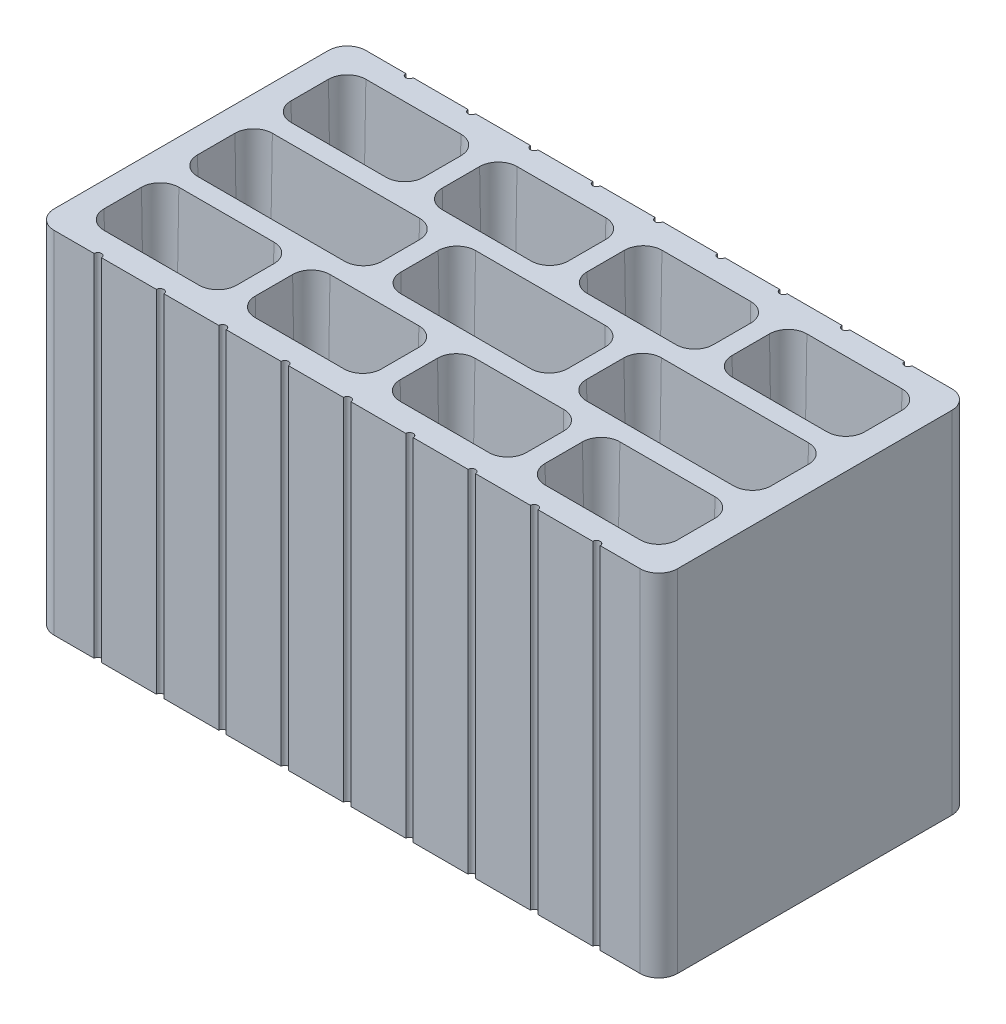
SolidWorks part; units mm, degrees
ref_plane "Plan de face" through (0, 0, 0) normal (0, 0, 1) x (1, 0, 0)
ref_plane "Plan de dessus" through (0, 0, 0) normal (0, 1, 0) x (1, 0, 0)
ref_plane "Plan de droite" through (0, 0, 0) normal (1, 0, 0) x (0, 0, -1)
sketch "Esquisse1" plane through (0, 0, 0) normal (0, 1, 0) x (1, 0, 0)
  line L0 (-4.5271, 0) -> (72.4679, 0) construction
  line L1 (1.5, 0) -> (4.7, 0)
  line L2 (0, 1.5) -> (0, 23.5)
  line L3 (1.5, 25) -> (4.7, 25)
  line L4 (50, 1.5) -> (50, 23.5)
  line L5 (0, -4.2553) -> (0, 43.6965) construction
  line L6 (25, -2.4119) -> (25, 43.6965) construction
  line L7 (-4.5271, 12.5) -> (72.4679, 12.5) construction
  line L8 (12.625, -2.4119) -> (12.625, 14.3543) construction
  line L9 (-4.5271, 2) -> (51.055, 2) construction
  line L10 (2, 28.4811) -> (2, -4.2553) construction
  line L11 (-3.7698, 9.5) -> (51.8514, 9.5) construction
  line L12 (-2.4036, 8.75) -> (-0.3375, 8.75) construction
  line L13 (8, 13.5253) -> (8, 5.2262) construction
  line L14 (3.5, 8) -> (11.125, 8)
  line L15 (2, 6.5) -> (2, 3.5)
  line L16 (13.375, -4.2553) -> (13.375, 14.3543) construction
  line L17 (14.125, -2.4119) -> (14.125, 14.3543) construction
  line L18 (-3.7698, 8) -> (25.3515, 8) construction
  line L19 (3.5, 2) -> (11.125, 2)
  line L20 (12.625, 6.5) -> (12.625, 3.5)
  line L21 (15.625, 8) -> (22.75, 8)
  line L22 (14.125, 6.5) -> (14.125, 3.5)
  line L23 (15.625, 2) -> (22.75, 2)
  line L24 (16.8, 4.1469) -> (16.8, 16.2448) construction
  line L25 (8.625, 13.5253) -> (8.625, 6.2202) construction
  line L26 (9.25, 13.5253) -> (9.25, 5.2262) construction
  line L27 (24.25, 6.5) -> (24.25, 3.5)
  line L28 (48, -3.2031) -> (48, 26.4901) construction
  line L29 (-3.1448, 23) -> (51.68, 23) construction
  line L30 (34.375, 17) -> (27.25, 17)
  line L31 (25.75, 1.0051) -> (25.75, -4.2553) construction
  line L32 (18.3, 4.1469) -> (18.3, 16.2448) construction
  line L33 (19.8, 15.5) -> (30.2, 15.5)
  line L34 (3.5, 15.5) -> (15.3, 15.5)
  line L35 (2, 14) -> (2, 11)
  line L36 (3.5, 9.5) -> (15.3, 9.5)
  line L37 (16.8, 14) -> (16.8, 11)
  line L38 (18.3, 14) -> (18.3, 11)
  line L39 (-3.2698, 15.5) -> (52.3514, 15.5) construction
  line L40 (30.2, 9.5) -> (19.8, 9.5)
  line L41 (31.7, 4.1469) -> (31.7, 16.2448) construction
  line L42 (40.75, 13.5253) -> (40.75, 5.2262) construction
  line L43 (41.375, 13.5253) -> (41.375, 6.2202) construction
  line L44 (33.2, 4.1469) -> (33.2, 16.2448) construction
  line L45 (42, 13.5253) -> (42, 5.2262) construction
  line L46 (46.5, 17) -> (38.875, 17)
  line L47 (48, 18.5) -> (48, 21.5)
  line L48 (46.5, 23) -> (38.875, 23)
  line L49 (37.375, 18.5) -> (37.375, 21.5)
  line L50 (35.875, 18.5) -> (35.875, 21.5)
  line L51 (34.375, 23) -> (27.25, 23)
  line L52 (25.75, 18.5) -> (25.75, 21.5)
  line L53 (24.25, 18.5) -> (24.25, 21.5)
  line L54 (12.625, 18.5) -> (12.625, 21.5)
  line L55 (3.5, 23) -> (11.125, 23)
  line L56 (2, 18.5) -> (2, 21.5)
  line L57 (3.5, 17) -> (11.125, 17)
  line L58 (15.625, 23) -> (22.75, 23)
  line L59 (14.125, 18.5) -> (14.125, 21.5)
  line L60 (31.7, 14) -> (31.7, 11)
  line L61 (33.2, 14) -> (33.2, 11)
  line L62 (46.5, 9.5) -> (34.7, 9.5)
  line L63 (48, 14) -> (48, 11)
  line L64 (46.5, 15.5) -> (34.7, 15.5)
  line L65 (15.625, 17) -> (22.75, 17)
  line L66 (25.75, 6.5) -> (25.75, 3.5)
  line L67 (34.375, 2) -> (27.25, 2)
  line L68 (35.875, 6.5) -> (35.875, 3.5)
  line L69 (34.375, 8) -> (27.25, 8)
  line L70 (37.375, 6.5) -> (37.375, 3.5)
  line L71 (46.5, 2) -> (38.875, 2)
  line L72 (48, 6.5) -> (48, 3.5)
  line L73 (46.5, 8) -> (38.875, 8)
  line L74 (5.3, 0) -> (9.7, 0)
  line L75 (10.3, 0) -> (14.7, 0)
  line L76 (15.3, 0) -> (19.7, 0)
  line L77 (20.3, 0) -> (24.7, 0)
  line L78 (25.3, 0) -> (29.7, 0)
  line L79 (30.3, 0) -> (34.7, 0)
  line L80 (35.3, 0) -> (39.7, 0)
  line L81 (40.3, 0) -> (44.7, 0)
  line L82 (45.3, 0) -> (48.5, 0)
  line L83 (5.3, 25) -> (9.7, 25)
  line L84 (10.3, 25) -> (14.7, 25)
  line L85 (15.3, 25) -> (19.7, 25)
  line L86 (20.3, 25) -> (24.7, 25)
  line L87 (45.3, 25) -> (48.5, 25)
  line L88 (40.3, 25) -> (44.7, 25)
  line L89 (35.3, 25) -> (39.7, 25)
  line L90 (30.3, 25) -> (34.7, 25)
  line L91 (25.3, 25) -> (29.7, 25)
  line L98 (24.25, -4.2553) -> (24.25, 28.4811) construction
  arc A0 (45.3, 25) -> (44.7, 25) centre (45, 25) cw
  arc A1 (5.3, 0) -> (4.7, 0) centre (5, 0) ccw
  arc A2 (10.3, 0) -> (9.7, 0) centre (10, 0) ccw
  arc A3 (15.3, 0) -> (14.7, 0) centre (15, 0) ccw
  arc A4 (20.3, 0) -> (19.7, 0) centre (20, 0) ccw
  arc A5 (25.3, 0) -> (24.7, 0) centre (25, 0) ccw
  arc A6 (30.3, 0) -> (29.7, 0) centre (30, 0) ccw
  arc A7 (35.3, 0) -> (34.7, 0) centre (35, 0) ccw
  arc A8 (40.3, 0) -> (39.7, 0) centre (40, 0) ccw
  arc A9 (45.3, 0) -> (44.7, 0) centre (45, 0) ccw
  circle A10 centre (0, 0) radius 0.3
  arc A11 (40.3, 25) -> (39.7, 25) centre (40, 25) cw
  arc A12 (35.3, 25) -> (34.7, 25) centre (35, 25) cw
  arc A13 (30.3, 25) -> (29.7, 25) centre (30, 25) cw
  arc A14 (25.3, 25) -> (24.7, 25) centre (25, 25) cw
  arc A15 (20.3, 25) -> (19.7, 25) centre (20, 25) cw
  arc A16 (15.3, 25) -> (14.7, 25) centre (15, 25) cw
  arc A17 (10.3, 25) -> (9.7, 25) centre (10, 25) cw
  arc A18 (5.3, 25) -> (4.7, 25) centre (5, 25) cw
  arc A19 (48, 21.5) -> (46.5, 23) centre (46.5, 21.5) ccw
  arc A20 (46.5, 17) -> (48, 18.5) centre (46.5, 18.5) ccw
  arc A21 (48, 14) -> (46.5, 15.5) centre (46.5, 14) ccw
  arc A22 (46.5, 9.5) -> (48, 11) centre (46.5, 11) ccw
  arc A23 (33.2, 11) -> (34.7, 9.5) centre (34.7, 11) ccw
  arc A24 (31.7, 11) -> (30.2, 9.5) centre (30.2, 11) cw
  arc A25 (31.7, 14) -> (30.2, 15.5) centre (30.2, 14) ccw
  arc A26 (33.2, 14) -> (34.7, 15.5) centre (34.7, 14) cw
  arc A27 (38.875, 17) -> (37.375, 18.5) centre (38.875, 18.5) cw
  arc A28 (38.875, 23) -> (37.375, 21.5) centre (38.875, 21.5) ccw
  arc A29 (35.875, 21.5) -> (34.375, 23) centre (34.375, 21.5) ccw
  arc A30 (34.375, 17) -> (35.875, 18.5) centre (34.375, 18.5) ccw
  arc A31 (27.25, 17) -> (25.75, 18.5) centre (27.25, 18.5) cw
  arc A32 (27.25, 23) -> (25.75, 21.5) centre (27.25, 21.5) ccw
  arc A33 (24.25, 18.5) -> (22.75, 17) centre (22.75, 18.5) cw
  arc A34 (24.25, 21.5) -> (22.75, 23) centre (22.75, 21.5) ccw
  arc A35 (15.625, 23) -> (14.125, 21.5) centre (15.625, 21.5) ccw
  arc A36 (14.125, 18.5) -> (15.625, 17) centre (15.625, 18.5) ccw
  arc A37 (19.8, 15.5) -> (18.3, 14) centre (19.8, 14) ccw
  arc A38 (18.3, 11) -> (19.8, 9.5) centre (19.8, 11) ccw
  arc A39 (15.3, 9.5) -> (16.8, 11) centre (15.3, 11) ccw
  arc A40 (15.3, 15.5) -> (16.8, 14) centre (15.3, 14) cw
  arc A41 (12.625, 18.5) -> (11.125, 17) centre (11.125, 18.5) cw
  arc A42 (12.625, 21.5) -> (11.125, 23) centre (11.125, 21.5) ccw
  arc A43 (3.5, 23) -> (2, 21.5) centre (3.5, 21.5) ccw
  arc A44 (2, 18.5) -> (3.5, 17) centre (3.5, 18.5) ccw
  arc A45 (3.5, 15.5) -> (2, 14) centre (3.5, 14) ccw
  arc A46 (2, 11) -> (3.5, 9.5) centre (3.5, 11) ccw
  arc A47 (48.5, 25) -> (50, 23.5) centre (48.5, 23.5) cw
  arc A48 (48.5, 0) -> (50, 1.5) centre (48.5, 1.5) ccw
  arc A49 (46.5, 2) -> (48, 3.5) centre (46.5, 3.5) ccw
  arc A50 (48, 6.5) -> (46.5, 8) centre (46.5, 6.5) ccw
  arc A51 (37.375, 6.5) -> (38.875, 8) centre (38.875, 6.5) cw
  arc A52 (37.375, 3.5) -> (38.875, 2) centre (38.875, 3.5) ccw
  arc A53 (34.375, 2) -> (35.875, 3.5) centre (34.375, 3.5) ccw
  arc A54 (35.875, 6.5) -> (34.375, 8) centre (34.375, 6.5) ccw
  arc A55 (25.75, 3.5) -> (27.25, 2) centre (27.25, 3.5) ccw
  arc A56 (22.75, 2) -> (24.25, 3.5) centre (22.75, 3.5) ccw
  arc A57 (24.25, 6.5) -> (22.75, 8) centre (22.75, 6.5) ccw
  arc A58 (15.625, 8) -> (14.125, 6.5) centre (15.625, 6.5) ccw
  arc A59 (14.125, 3.5) -> (15.625, 2) centre (15.625, 3.5) ccw
  arc A60 (11.125, 2) -> (12.625, 3.5) centre (11.125, 3.5) ccw
  arc A61 (11.125, 8) -> (12.625, 6.5) centre (11.125, 6.5) cw
  arc A62 (3.5, 8) -> (2, 6.5) centre (3.5, 6.5) ccw
  arc A63 (2, 3.5) -> (3.5, 2) centre (3.5, 3.5) ccw
  arc A64 (1.5, 0) -> (0, 1.5) centre (1.5, 1.5) cw
  arc A65 (0, 23.5) -> (1.5, 25) centre (1.5, 23.5) cw
  arc A66 (25.75, 6.5) -> (27.25, 8) centre (27.25, 6.5) cw
  point P161 (48, 23)
  point P164 (48, 17)
  point P167 (48, 15.5)
  point P170 (48, 9.5)
  point P173 (33.2, 9.5)
  point P176 (31.7, 9.5)
  point P179 (31.7, 15.5)
  point P182 (33.2, 15.5)
  point P185 (37.375, 17)
  point P188 (37.375, 23)
  point P191 (35.875, 23)
  point P194 (35.875, 17)
  point P197 (25.75, 17)
  point P200 (25.75, 23)
  point P203 (24.25, 17)
  point P206 (24.25, 23)
  point P209 (14.125, 23)
  point P212 (14.125, 17)
  point P215 (18.3, 15.5)
  point P218 (18.3, 9.5)
  point P221 (16.8, 9.5)
  point P224 (16.8, 15.5)
  point P227 (12.625, 17)
  point P230 (12.625, 23)
  point P233 (2, 23)
  point P236 (2, 17)
  point P239 (2, 15.5)
  point P242 (2, 9.5)
  point P247 (50, 0)
  point P250 (48, 2)
  point P253 (48, 8)
  point P256 (37.375, 8)
  point P259 (37.375, 2)
  point P262 (35.875, 2)
  point P265 (35.875, 8)
  point P268 (25.75, 2)
  point P271 (24.25, 2)
  point P274 (24.25, 8)
  point P277 (14.125, 8)
  point P280 (14.125, 2)
  point P283 (12.625, 2)
  point P286 (12.625, 8)
  point P289 (2, 8)
  point P292 (2, 2)
  point P295 (0, 0)
  point P298 (0, 25)
  point P301 (25.75, 8)
  dimension "D20" = 10
  dimension "D21" = 1.5
  dimension "D22" = 1.5
  dimension "D1" = 25
  dimension "D2" = 12.5
  dimension "D3" = 2
  dimension "D4" = 2
  dimension "D5" = 6
  dimension "D6" = 1.5
  dimension "D7" = 0.75
  dimension "D8" = 11.375
  dimension "D9" = 0.75
  dimension "D10" = 0.75
  dimension "D11" = 1.25
  dimension "D12" = 0.625
  dimension "D13" = 6
  dimension "D14" = 0.75
  dimension "D15" = 1.5
  dimension "D16" = 14.8
  dimension "D17" = 1.5
  dimension "D18" = 2
  dimension "D19" = 6
extrude "Boss.-Extru.1" add sketch "Esquisse1" along normal blind 28.125
draft "Dépouille1" type of draft neutral plane draft angle 1 faces to draft 88 parameters "D1"=1
